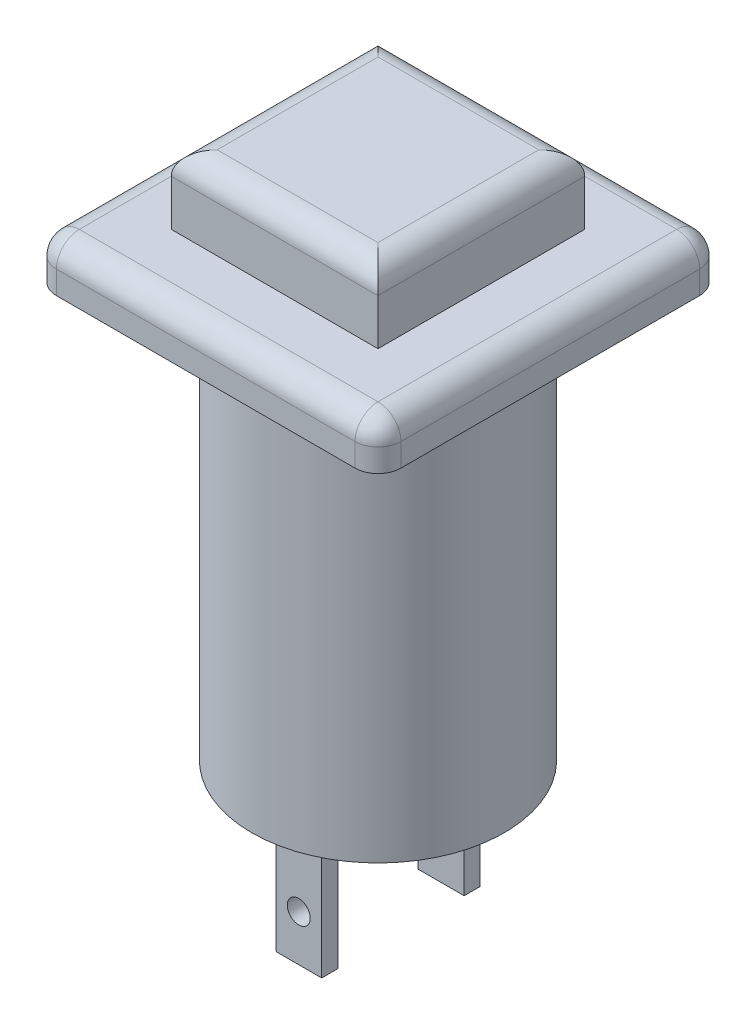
SolidWorks part; units mm, degrees
ref_plane "Face" through (0, 0, 0) normal (0, 0, 1) x (1, 0, 0)
ref_plane "Dessus" through (0, 0, 0) normal (0, 1, 0) x (1, 0, 0)
ref_plane "Droite" through (0, 0, 0) normal (1, 0, 0) x (0, 0, -1)
sketch "Esquisse1" plane through (0, 0, 0) normal (0, 0, 1) x (1, 0, 0)
  line L0 (-19.1837, -19.0591) -> (-26.1837, -19.0591)
  line L1 (-26.1837, -19.0591) -> (-26.1837, -22.0591)
  line L2 (-26.1837, -22.0591) -> (-31.1837, -22.0591)
  line L3 (-31.1837, -22.0591) -> (-31.1837, -24.0591)
  line L4 (-31.1837, -24.0591) -> (-24.6837, -24.0591)
  line L5 (-24.6837, -24.0591) -> (-24.6837, -42.0591)
  line L6 (-24.6837, -42.0591) -> (-19.1837, -42.0591)
  line L7 (-19.1837, -19.0591) -> (-19.1837, -42.0591)
  line L8 (-19.1837, -19.0286) -> (-19.1837, -37.5227) construction
  dimension "D1" = 5.5
  dimension "D2" = 18
  dimension "D3" = 2
  dimension "D4" = 3
  dimension "D5" = 7
  dimension "D6" = 12
revolve "Révolution1" add sketch "Esquisse1" angle 360 about L8
sketch "Esquisse2" plane through (0, -19.0591, 0) normal (0, 1, 0) x (-1, 0, 0)
  line L1 (14.6837, 4.5) -> (23.6837, 4.5)
  line L2 (14.6837, 4.5) -> (14.6837, -4.5)
  line L3 (14.6837, -4.5) -> (23.6837, -4.5)
  line L4 (23.6837, 4.5) -> (23.6837, -4.5)
  dimension "D1" = 9
  dimension "D2" = 9
  dimension "D3" = 4.5
  dimension "D4" = 4.5
extrude "Enlèv. mat.-Extru.1" cut sketch "Esquisse2" against normal blind 3 flip side to cut
fillet "Congé1" radius 1
sketch "Esquisse3" plane through (0, -22.0591, 0) normal (0, 1, 0) x (-1, 0, 0)
  line L1 (11.6837, 7.5) -> (26.6837, 7.5)
  line L2 (11.6837, 7.5) -> (11.6837, -7.5)
  line L3 (11.6837, -7.5) -> (26.6837, -7.5)
  line L4 (26.6837, 7.5) -> (26.6837, -7.5)
  dimension "D1" = 15
  dimension "D2" = 15
  dimension "D3" = 7.5
  dimension "D4" = 7.5
extrude "Enlèv. mat.-Extru.2" cut sketch "Esquisse3" against normal blind 10 flip side to cut
fillet "Congé2" radius 1
sketch "Esquisse4" plane through (0, -42.0591, 0) normal (0, -1, 0) x (1, 0, 0)
  line L1 (-20.1837, 3.45) -> (-18.1837, 3.45)
  line L2 (-20.1837, 3.45) -> (-20.1837, 2.75)
  line L3 (-20.1837, 2.75) -> (-18.1837, 2.75)
  line L4 (-18.1837, 3.45) -> (-18.1837, 2.75)
  line L5 (-20.1837, -2.75) -> (-18.1837, -2.75)
  line L6 (-20.1837, -2.75) -> (-20.1837, -3.45)
  line L7 (-20.1837, -3.45) -> (-18.1837, -3.45)
  line L8 (-18.1837, -2.75) -> (-18.1837, -3.45)
  dimension "D1" = 2
  dimension "D2" = 0.7
  dimension "D3" = 1
  dimension "D4" = 5.5
  dimension "D5" = 2.75
extrude "Extrusion1" add sketch "Esquisse4" along normal blind 6
sketch "Esquisse5" plane through (0, 0, 3.45) normal (0, 0, 1) x (1, 0, 0)
  line L0 (-19.1837, -19.0286) -> (-19.1837, -37.5227) construction
  line L1 (-24.6837, -42.0591) -> (-13.6837, -42.0591) construction
  circle A0 centre (-19.1837, -46.0591) radius 0.5
  dimension "D1" = 1
  dimension "D2" = 4
extrude "Enlèv. mat.-Extru.3" cut sketch "Esquisse5" against normal through all
